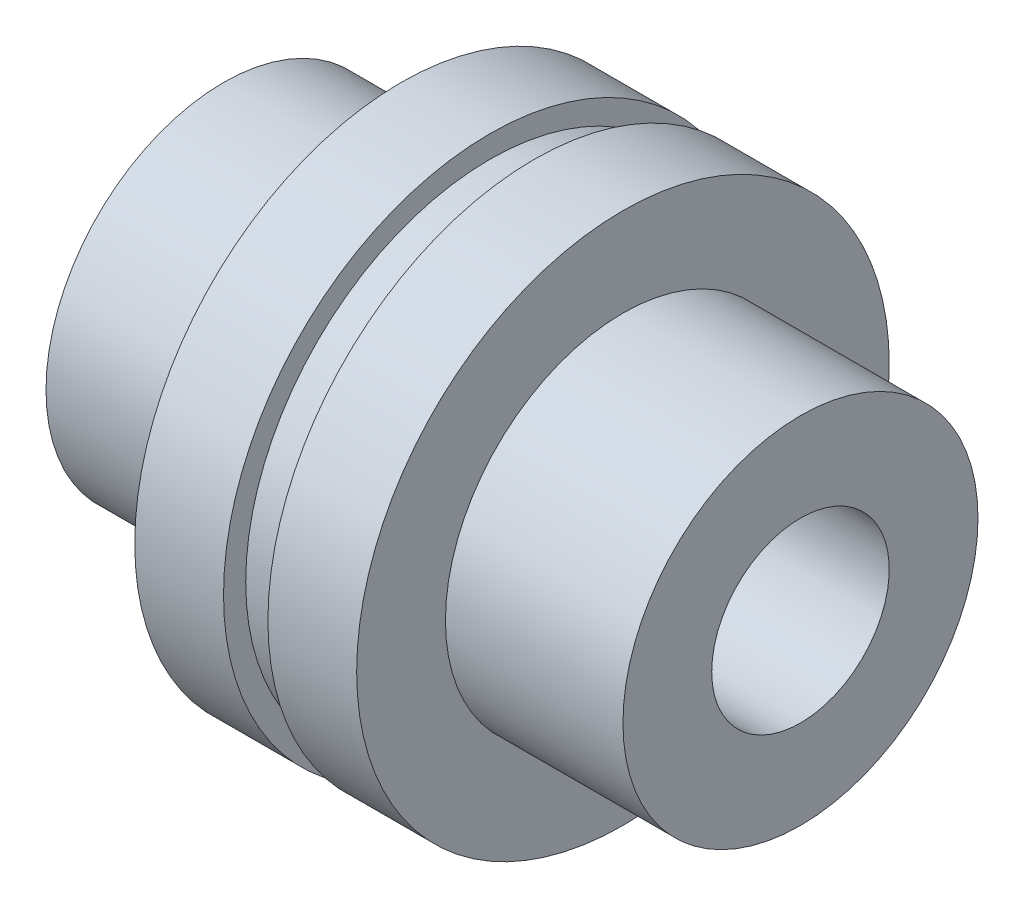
SolidWorks part; units mm, degrees
ref_plane "front" through (0, 0, 0) normal (0, 0, 1) x (1, 0, 0)
ref_plane "top" through (0, 0, 0) normal (0, 1, 0) x (1, 0, 0)
ref_plane "side" through (0, 0, 0) normal (1, 0, 0) x (0, 0, -1)
sketch "Sketch1" plane through (0, 0, 0) normal (0, 0, 1) x (1, 0, 0)
  line L0 (0, 0) -> (65.5339, 0) construction
  line L1 (0, 12.7) -> (0, 25.4)
  line L2 (0, 25.4) -> (25.4, 25.4)
  line L3 (25.4, 25.4) -> (25.4, 38.1)
  line L4 (25.4, 38.1) -> (38.1, 38.1)
  line L5 (38.1, 38.1) -> (38.1, 34.925)
  line L6 (38.1, 34.925) -> (44.45, 34.925)
  line L7 (41.275, 34.925) -> (41.275, 0) construction
  line L8 (0, 12.7) -> (82.55, 12.7)
  line L9 (0, -50) -> (0, 50) construction
  line L10 (44.45, 38.1) -> (44.45, 34.925)
  line L11 (57.15, 38.1) -> (44.45, 38.1)
  line L12 (57.15, 25.4) -> (57.15, 38.1)
  line L13 (82.55, 25.4) -> (57.15, 25.4)
  line L14 (82.55, 12.7) -> (82.55, 25.4)
  point P15 (41.275, 12.7)
  point P16 (41.275, 34.925)
  dimension "D1" = 12.7
  dimension "D2" = 25.4
  dimension "D3" = 38.1
  dimension "D4" = 3.175
  dimension "D5" = 25.4
  dimension "D6" = 38.1
  dimension "D7" = 3.175
revolve "Base-Revolve" add sketch "Sketch1" angle 360 about L0
